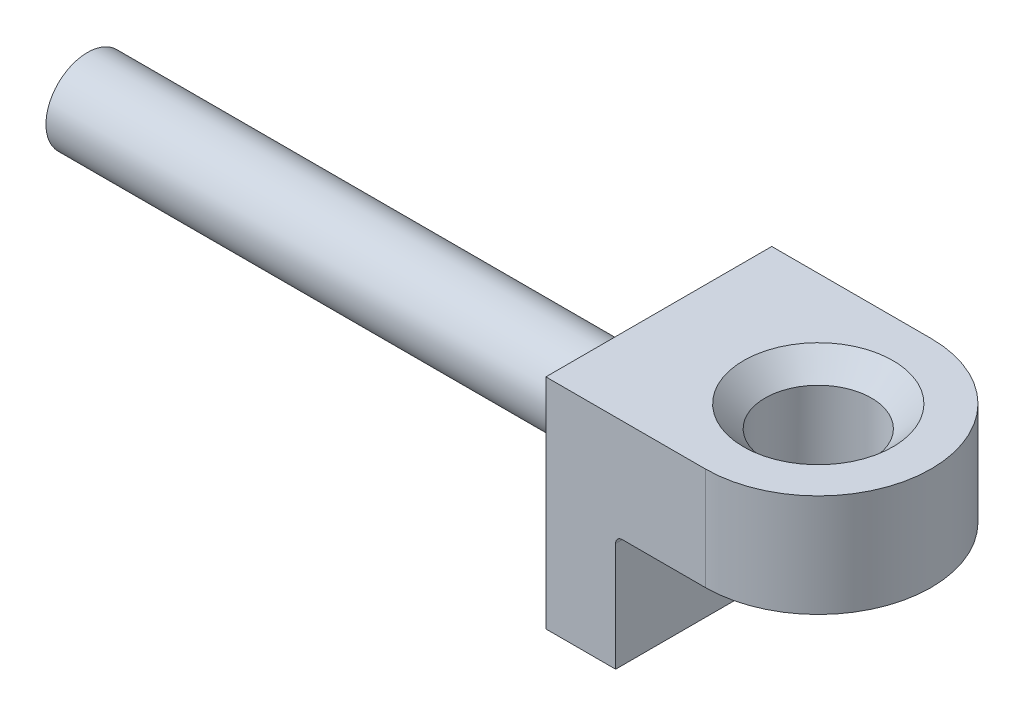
SolidWorks part; units mm, degrees
ref_plane "Front Plane" through (0, 0, 0) normal (0, 0, 1) x (1, 0, 0)
ref_plane "Top Plane" through (0, 0, 0) normal (0, 1, 0) x (1, 0, 0)
ref_plane "Right Plane" through (0, 0, 0) normal (1, 0, 0) x (0, 0, -1)
sketch "Sketch1" plane through (0, 0, 0) normal (1, 0, 0) x (0, 0, -1)
  circle A0 centre (0, 0) radius 1.5875
  dimension "D1" = 3.175
extrude "Boss-Extrude1" add sketch "Sketch1" against normal blind 21.844
sketch "Sketch2" plane through (0, 0, 0) normal (0, 1, 0) x (1, 0, 0)
  line L0 (0, 0) -> (6.096, 0) construction
  line L1 (6.096, 4.318) -> (0, 4.318)
  line L2 (0, 4.318) -> (0, -4.318)
  line L3 (0, -4.318) -> (6.096, -4.318)
  arc A0 (6.096, -4.318) -> (6.096, 4.318) centre (6.096, 0) ccw
  circle A1 centre (6.096, 0) radius 2.032
  dimension "D2" = 4.318
  dimension "D3" = 4.064
  dimension "D1" = 6.096
extrude "Boss-Extrude2" add sketch "Sketch2" along normal blind 3.9268 and the other way blind 4.4196
sketch "Sketch3" plane through (0, 0, 0) normal (0, 0, 1) x (1, 0, 0)
  line L0 (0, -4.4196) -> (6.096, -4.4196) construction
  line L1 (10.414, 0) -> (2.667, 0)
  line L2 (10.414, 0) -> (10.414, -4.4196)
  line L3 (10.414, -4.4196) -> (2.667, -4.4196)
  line L4 (2.667, 0) -> (2.667, -4.4196)
  line L5 (0, -4.4196) -> (0, 3.9268) construction
  line L6 (10.414, -4.4196) -> (10.414, 3.9268) construction
  dimension "D1" = 2.667
extrude "Cut-Extrude1" cut sketch "Sketch3" against normal through all both and the other way through all
fillet "Fillet1" radius 0.0508 1 edges at (0, 0, -1.5875)
fillet "Fillet2" radius 0.254 1 edges at (2.667, 0, 0)
chamfer "Chamfer1" distance 0.8255 angle 45 1 edges at (6.096, 3.9268, 2.032)
